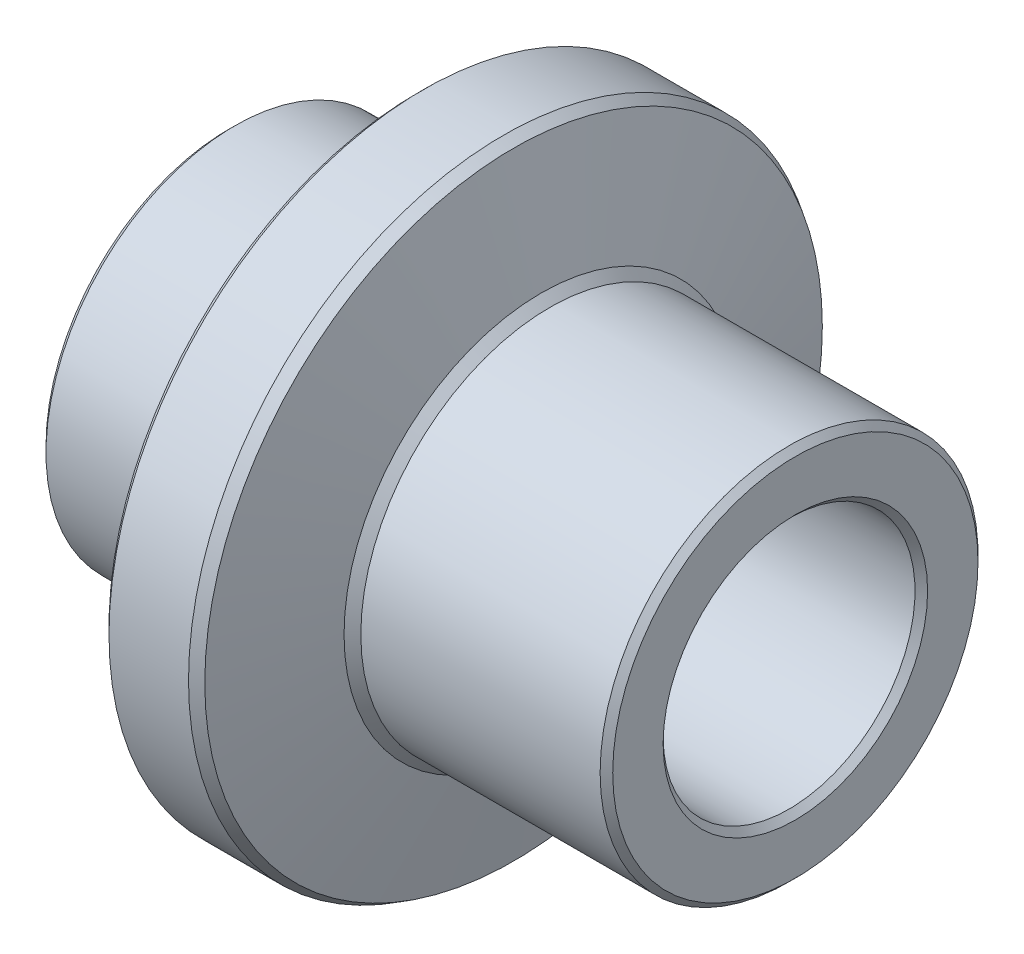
SolidWorks part; units mm, degrees
ref_plane "Спереди" through (0, 0, 0) normal (0, 0, 1) x (1, 0, 0)
ref_plane "Сверху" through (0, 0, 0) normal (0, 1, 0) x (1, 0, 0)
ref_plane "Справа" through (0, 0, 0) normal (1, 0, 0) x (0, 0, -1)
sketch "Эскиз1" plane through (0, 0, 0) normal (0, 0, 1) x (1, 0, 0)
  line L0 (0, 0) -> (67.1701, 0) construction
  line L1 (17.9973, 4) -> (0, 4)
  line L2 (0, 4) -> (0, 6)
  line L3 (0, 6) -> (6, 6)
  line L4 (6, 6) -> (6, 10)
  line L5 (6, 10) -> (9, 10)
  line L6 (9, 10) -> (9.9973, 6)
  line L7 (9.9973, 6) -> (17.9973, 6)
  line L8 (17.9973, 6) -> (17.9973, 4)
  dimension "D1" = 8
  dimension "D2" = 12
  dimension "D3" = 6
  dimension "D4" = 20
  dimension "D5" = 3
  dimension "D6" = 14
  dimension "D7" = 8
revolve "Повернуть1" add sketch "Эскиз1" angle 360 about L0
chamfer "Фаска1" distance 0.2 angle 45 8 edges at (6, 0, 6) (0, 0, 6) (9, 0, 10) (6, 0, 10) (17.9973, 0, 6) (9.9973, 0, 6) (0, 0, 4) (17.9973, 0, 4)
